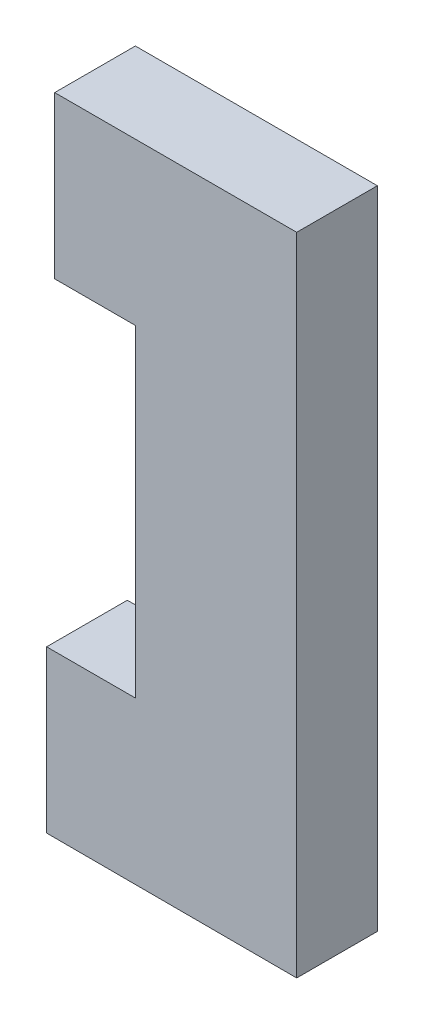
SolidWorks part; units mm, degrees
ref_plane "Front Plane" through (0, 0, 0) normal (0, 0, 1) x (1, 0, 0)
ref_plane "Top Plane" through (0, 0, 0) normal (0, 1, 0) x (1, 0, 0)
ref_plane "Right Plane" through (0, 0, 0) normal (1, 0, 0) x (0, 0, -1)
sketch "Sketch1" plane through (0, 0, 0) normal (0, 0, 1) x (1, 0, 0)
  line L0 (17.0217, 27.7339) -> (47.0217, 27.7339)
  line L1 (47.0217, 27.7339) -> (47.0217, -52.3228)
  line L2 (47.0217, -52.3228) -> (16.0217, -52.2661)
  line L3 (16.0217, -52.2661) -> (16.0217, -32.2661)
  line L4 (16.0217, -32.2661) -> (27.0217, -32.2661)
  line L5 (27.0217, -32.2661) -> (27.0217, 7.7339)
  line L6 (27.0217, 7.7339) -> (17.0217, 7.7339)
  line L7 (17.0217, 7.7339) -> (17.0217, 27.7339)
  dimension "D1" = 30
  dimension "D2" = 10
  dimension "D3" = 40
extrude "Extrude1" add sketch "Sketch1" against normal up to surface (10 mm away)
